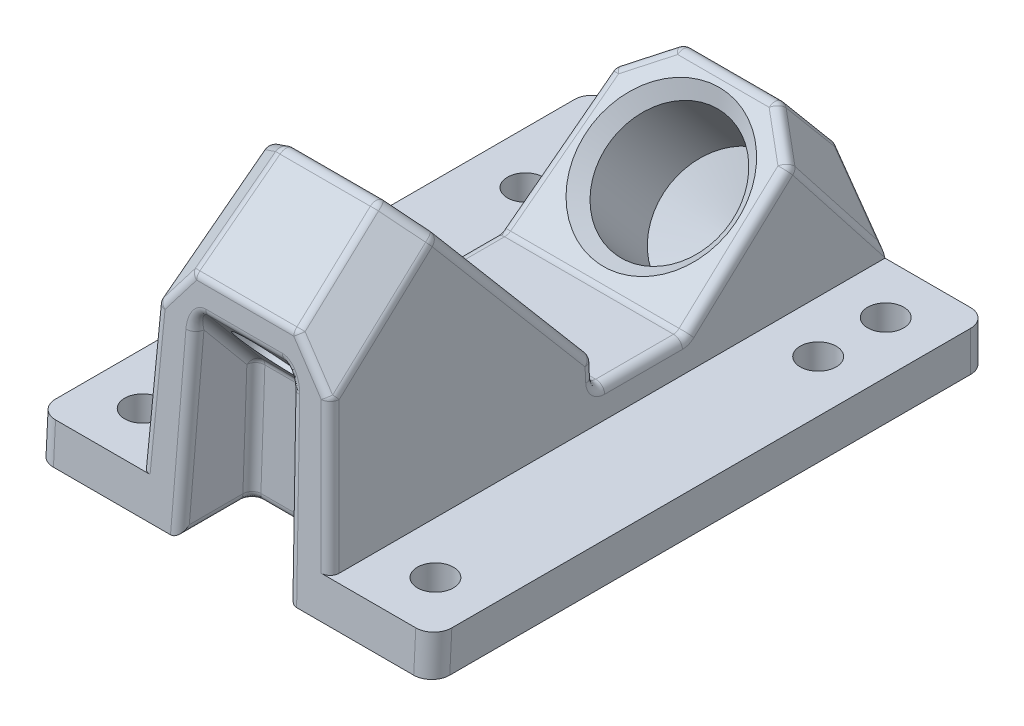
SolidWorks part; units mm, degrees
ref_plane "Front" through (0, 0, 0) normal (0, 0, 1) x (1, 0, 0)
ref_plane "Top" through (0, 0, 0) normal (0, 1, 0) x (1, 0, 0)
ref_plane "Right" through (0, 0, 0) normal (1, 0, 0) x (0, 0, -1)
sketch "Sketch2" plane through (0, 0, 0) normal (0, 1, 0) x (1, 0, 0)
  line L1 (-27.94, -39.116) -> (27.94, -39.116)
  line L2 (-27.94, -39.116) -> (-27.94, 39.116)
  line L3 (-27.94, 39.116) -> (27.94, 39.116)
  line L4 (27.94, -39.116) -> (27.94, 39.116)
  line L5 (-27.94, -39.116) -> (27.94, 39.116) construction
  line L6 (-27.94, 39.116) -> (27.94, -39.116) construction
  point P0 (0, 0)
  dimension "D1" = 78.232
  dimension "D2" = 55.88
extrude "Boss-Extrude1" add sketch "Sketch2" along normal blind 5.6388
draft "Draft1" type of draft neutral plane draft angle 3 faces to draft 1 parameters "D1"=3
sketch "Sketch3" plane through (0, 5.6388, 0) normal (0, 1, 0) x (1, 0, 0)
  line L0 (27.94, 39.116) -> (-27.94, 39.116) construction
  line L1 (-13.335, 39.116) -> (13.335, 39.116)
  line L2 (-13.335, 39.116) -> (-13.335, -39.116)
  line L3 (-13.335, -39.116) -> (13.335, -39.116)
  line L4 (13.335, 39.116) -> (13.335, -39.116)
  line L5 (-27.94, -39.116) -> (27.94, -39.116) construction
  point P8 (0, 39.116)
  dimension "D1" = 26.67
extrude "Boss-Extrude2" add sketch "Sketch3" along normal blind 41.91 draft 3
sketch "Sketch4" plane through (0, 0, 0) normal (1, 0, 0) x (0, 0, -1)
  line L1 (39.116, 5.6388) -> (39.116, 0) construction
  line L2 (-39.116, 5.6388) -> (39.116, 5.6388) construction
  line L3 (-1.524, 9.8298) -> (-1.524, 13.5128)
  line L4 (-39.116, 5.6388) -> (39.116, 5.6388) construction
  line L5 (-1.524, 9.8298) -> (11.176, 9.8298)
  line L6 (11.176, 9.8298) -> (30.6335, 26.1566)
  line L7 (30.6335, 26.1566) -> (38.5342, 16.741)
  line L8 (36.9196, 47.5488) -> (39.116, 5.6388) construction
  line L9 (-1.524, 13.5128) -> (-25.5244, 42.1154)
  line L10 (-25.5244, 42.1154) -> (-37.7416, 31.8639)
  line L11 (-36.9196, 47.5488) -> (-39.116, 5.6388) construction
  line L14 (-37.7416, 31.8639) -> (-36.9196, 47.5488)
  line L15 (-36.9196, 47.5488) -> (36.9196, 47.5488)
  line L16 (36.9196, 47.5488) -> (38.5342, 16.741)
  point P0 (-1.524, 9.8298)
  dimension "D1" = 40.64
  dimension "D2" = 4.191
  dimension "D3" = 7.874
  dimension "D4" = 12.7
  dimension "D5" = 37.338
  dimension "D6" = 50
  dimension "D7" = 25.4
extrude "Cut-Extrude1" cut sketch "Sketch4" against normal through all and the other way through all
sketch "Sketch5" plane through (0, 0.2653, 0.2226) normal (0, 0.766, 0.6428) x (1, 0, 0)
  line L0 (-12.2597, 40.2798) -> (-12.4381, 34.9831) construction
  line L1 (-13.1154, 14.8798) -> (-12.2597, 40.2798) construction
  line L2 (-12.4381, 34.9831) -> (-6.96, 40.2798)
  line L3 (-12.2597, 40.2798) -> (12.2597, 40.2798) construction
  line L4 (-6.96, 40.2798) -> (-12.2597, 40.2798)
  line L5 (0, 40.2798) -> (0, 14.8798) construction
  line L6 (-13.1154, 14.8798) -> (13.1154, 14.8798) construction
  line L7 (6.96, 40.2798) -> (12.2597, 40.2798)
  line L8 (12.4381, 34.9831) -> (6.96, 40.2798)
  line L9 (12.2597, 40.2798) -> (12.4381, 34.9831) construction
  line L10 (-12.2597, 40.2798) -> (-12.7532, 40.2798) construction
  line L11 (-12.7532, 40.2798) -> (-13.335, 33.5891) construction
  line L12 (-12.2597, 40.2798) -> (-12.7532, 40.2798)
  line L13 (-12.7532, 40.2798) -> (-13.285, 34.1643)
  line L14 (-12.4381, 34.9831) -> (-13.285, 34.1643)
  line L15 (12.4381, 34.9831) -> (13.285, 34.1643)
  line L16 (12.7532, 40.2798) -> (13.285, 34.1643)
  line L17 (12.2597, 40.2798) -> (12.7532, 40.2798)
  dimension "D1" = 7.62
extrude "Cut-Extrude2" cut sketch "Sketch5" against normal up to next
chamfer "Chamfer2" distance 4.572 angle 45 2 edges at (11.692, 36.9896, 31.633) (-11.692, 36.9896, 31.633)
sketch "Sketch6" plane through (0, 0, 0) normal (1, 0, 0) x (0, 0, -1)
  line L0 (-39.4115, 0) -> (39.116, 0) construction
  line L1 (-6.604, 13.9437) -> (-15.1856, 24.1709)
  line L2 (-6.604, 13.9437) -> (-6.604, 9.8298)
  line L3 (-1.524, 9.8298) -> (-1.524, 13.5128) construction
  line L4 (-17.8215, 25.4) -> (-11.4985, 25.4) construction
  line L5 (-1.524, 4.7498) -> (0, 4.7498)
  line L8 (0, 4.7498) -> (0, 0)
  line L10 (-21.2102, 22.5566) -> (-25.1875, 0)
  line L11 (-25.1875, 0) -> (0, 0)
  line L12 (-1.524, 13.5128) -> (-22.4627, 38.4666) construction
  arc A0 (-6.604, 9.8298) -> (-1.524, 4.7498) centre (-1.524, 9.8298) ccw
  arc A1 (-21.2102, 22.5566) -> (-15.1856, 24.1709) centre (-17.8215, 21.9591) cw
  point P0 (-17.8215, 25.4)
  dimension "D3" = 1.524
  dimension "D4" = 80
  dimension "D7" = 5.08
  dimension "D1" = 25.4
  dimension "D2" = 21.59
  dimension "D5" = 14.224
extrude "Cut-Extrude3" cut sketch "Sketch6" against normal mid plane 19.05
sketch "Sketch7" plane through (0, 0, 0) normal (1, 0, 0) x (0, 0, -1)
  line L0 (-29.2515, 0) -> (-29.2515, 17.7034)
  line L1 (-39.4115, 0) -> (39.116, 0) construction
  line L2 (-29.2515, 17.7034) -> (-37.941, 28.0591)
  line L3 (-38.0824, 25.3601) -> (-37.7416, 31.8639) construction
  line L4 (-37.941, 28.0591) -> (-39.4115, 0)
  line L5 (-39.4115, 0) -> (-29.2515, 0)
  line L6 (-1.524, 13.5128) -> (-22.4627, 38.4666) construction
  dimension "D1" = 10.16
  dimension "D2" = 3.81
extrude "Cut-Extrude4" cut sketch "Sketch7" against normal mid plane 15.24
sketch "Sketch9" plane through (0, 0, 0) normal (0, -1, 0) x (1, 0, 0)
  line L0 (0, -39.116) -> (0, 37.941) construction
  line L1 (27.94, -39.116) -> (-27.94, -39.116) construction
  line L2 (-7.62, 37.941) -> (7.62, 37.941) construction
  line L3 (7.62, 39.4115) -> (27.94, 39.4115) construction
  circle A0 centre (20.6375, 31.5883) radius 2.54
  circle A1 centre (20.6375, -22.3867) radius 2.54
  circle A2 centre (20.6375, -31.9117) radius 2.54
  circle A3 centre (-20.6375, -31.9117) radius 2.54
  circle A4 centre (-20.6375, -22.3867) radius 2.54
  circle A5 centre (-20.6375, 31.5883) radius 2.54
  dimension "D1" = 5.08
  dimension "D2" = 41.275
  dimension "D3" = 53.975
  dimension "D4" = 63.5
  dimension "D5" = 7.8232
extrude "Cut-Extrude6" cut sketch "Sketch9" against normal up to next
sketch "Sketch11" plane through (0, 0, 0) normal (1, 0, 0) x (0, 0, -1)
  line L0 (20.9048, 17.9932) -> (33.9662, 2.4272) construction
  line L1 (26.576, 22.752) -> (11.176, 9.8298) construction
  line L2 (11.176, 9.8298) -> (30.6335, 26.1566) construction
  line L3 (34.2248, 3.3217) -> (36.9395, 12.7141)
  line L4 (36.9395, 12.7141) -> (28.8578, 22.3456)
  line L5 (28.8578, 22.3456) -> (29.0769, 24.8505)
  line L6 (33.9662, 2.4272) -> (34.1295, 2.2326) construction
  line L7 (34.1295, 2.2326) -> (34.3241, 2.3959) construction
  line L8 (34.2248, 3.3217) -> (34.388, 3.1271) construction
  line L9 (33.9662, 2.4272) -> (34.2248, 3.3217) construction
  line L10 (34.1295, 2.2326) -> (20.9048, 17.9932)
  line L11 (20.9048, 17.9932) -> (29.0769, 24.8505)
  arc A0 (34.1295, 2.2326) -> (34.2248, 3.3217) centre (33.6326, 2.8248) ccw
  dimension "D6" = 0.254
  dimension "D1" = 8.89
  dimension "D2" = 20.32
  dimension "D3" = 14.351
  dimension "D4" = 45
  dimension "D5" = 1.778
  dimension "D7" = 0.254
  dimension "D8" = 0.254
revolve "Cut-Revolve1" cut sketch "Sketch11" angle 360 about L10
fillet "Fillet4" radius 2.54 4 edges at (27.94, 2.8194, -39.116) (-27.94, 2.8194, -39.116) (-27.94, 2.8194, 39.2638) (27.94, 2.8194, 39.2638)
fillet "Fillet5" radius 1.27 35 edges at (-13.0189, 11.6713, 1.524) (13.0189, 11.6713, 1.524) (-12.7767, 16.2909, -18.876) (-9.6991, 24.4543, -28.6048) (0, 26.1566, -30.6335) (9.6991, 24.4543, -28.6048) (12.7767, 16.2909, -18.876) (-13.1154, 9.8298, -4.826) (0, 9.8298, -11.176) (13.1154, 9.8298, -4.826) (0, 9.8298, 1.524) (-9.2317, 40.291, 23.9936) (-12.2685, 25.9897, 11.9934) (0, 13.5128, 1.524) (12.2685, 25.9897, 11.9934) (9.2317, 40.291, 23.9936) (0, 42.1154, 25.5244) (0, 0, 25.1875) (0, 0, 0) (-9.525, 19.0573, 10.8948) (-9.525, 11.8867, 6.604) (-9.525, 6.2377, 5.1161) (-9.525, 4.7498, 0.762) (-9.525, 2.3749, 0) (-9.525, 0, 12.5938) (-9.525, 11.2783, 23.1989) (-9.525, 25.2828, 18.7121) (9.525, 11.2783, 23.1989) (9.525, 0, 12.5938) (9.525, 2.3749, 0) (9.525, 4.7498, 0.762) (9.525, 6.2377, 5.1161) (9.525, 11.8867, 6.604) (9.525, 19.0573, 10.8948) (9.525, 25.2828, 18.7121)
draft "Draft2" type of draft neutral plane draft angle 2 faces to draft 2 parameters "D1"=2
sketch "Sketch8" plane through (0, -7.0889, 8.4483) normal (0, -0.6428, 0.766) x (1, 0, 0)
  line L0 (0, 45.8826) -> (0, 32.3641) construction
  line L1 (-6.6402, 45.8826) -> (6.6402, 45.8826) construction
  line L2 (-7.0018, 32.3641) -> (7.0018, 32.3641) construction
  circle A0 centre (0, 39.8818) radius 4.7308
  point P8 (0, 44.6126)
  dimension "D1" = 9.4615
  dimension "D2" = 1.27
extrude "Cut-Extrude5" cut sketch "Sketch8" against normal up to next
fillet "Fillet7" radius 1.27 35 edges at (0, 28.0591, 37.941) (11.2758, 38.1095, 22.6291) (-11.2758, 38.1095, 22.6291) (-6.7326, 41.5899, 25.5552) (6.7326, 41.5899, 25.5552) (6.8096, 25.6326, -30.5877) (-6.8096, 25.6326, -30.5877) (-12.1052, 22.3388, -26.6346) (12.1052, 22.3388, -26.6346) (-7.1301, 14.0296, 38.6763) (-6.821, 22.8813, 33.5963) (-7.62, 0, 34.3315) (6.821, 22.8813, 33.5963) (7.1301, 14.0296, 38.6763) (7.62, 0, 34.3315) (0, 0, 29.2515) (-7.3109, 8.8517, 29.2515) (0, 17.7034, 29.2515) (7.3109, 8.8517, 29.2515) (9.8437, 28.612, 37.912) (11.9789, 31.5149, 30.7474) (-9.8437, 28.612, 37.912) (-11.9789, 31.5149, 30.7474) (0, 31.8639, 37.7416) (-7.1388, 36.5815, 32.1194) (7.1388, 36.5815, 32.1194) (0, 16.741, -38.5342) (6.96, 20.9624, -34.992) (-6.96, 20.9624, -34.992) (-12.8879, 14.1698, -33.2097) (10.1225, 11.6671, -38.8001) (-10.1225, 11.6671, -38.8001) (12.8879, 14.1698, -33.2097)
